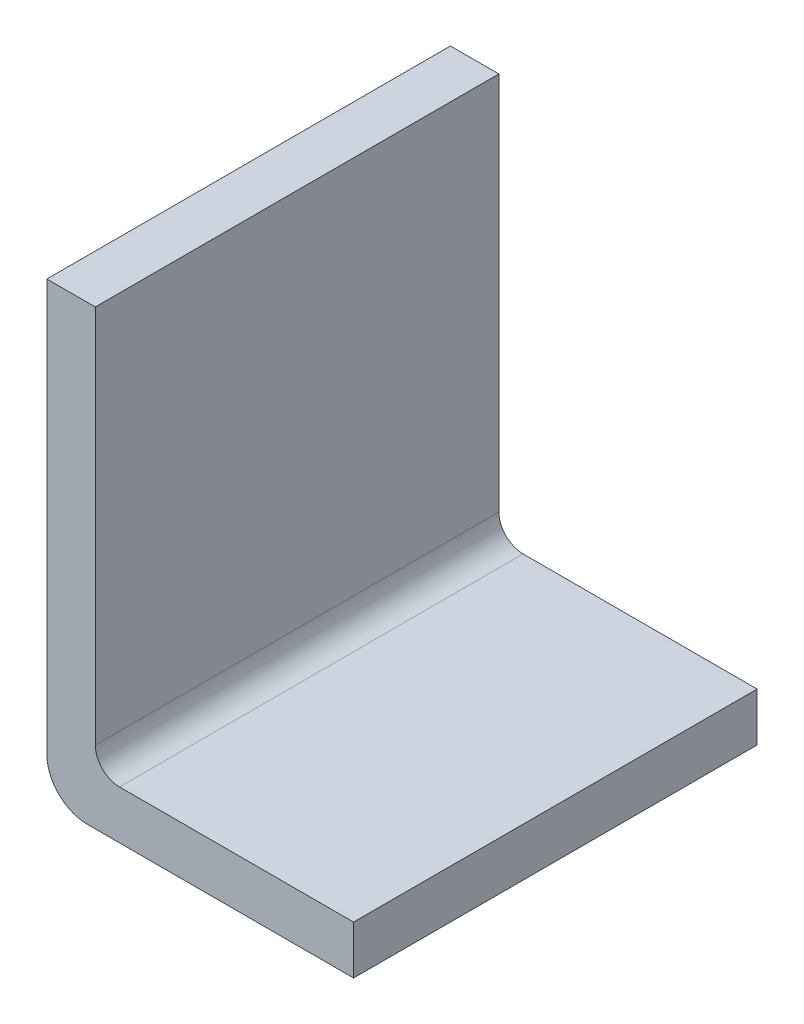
SolidWorks part; units mm, degrees
ref_plane "前视基准面" through (0, 0, 0) normal (0, 0, 1) x (1, 0, 0)
ref_plane "上视基准面" through (0, 0, 0) normal (0, 1, 0) x (1, 0, 0)
ref_plane "右视基准面" through (0, 0, 0) normal (1, 0, 0) x (0, 0, -1)
sketch "草图1" plane through (0, 0, 0) normal (0, 0, 1) x (1, 0, 0)
  line L0 (0, 56) -> (0, 5)
  line L1 (5, 0) -> (38, 0)
  line L2 (38, 0) -> (38, 6)
  line L3 (38, 6) -> (9, 6)
  line L4 (6, 9) -> (6, 56)
  line L5 (6, 56) -> (0, 56)
  arc A0 (0, 5) -> (5, 0) centre (5, 5) ccw
  arc A1 (9, 6) -> (6, 9) centre (9, 9) cw
  point P9 (0, 0)
  dimension "D5" = 5
  dimension "D6" = 3
  dimension "D1" = 56
  dimension "D2" = 6
  dimension "D3" = 6
  dimension "D4" = 32
extrude "拉伸1" add sketch "草图1" along normal blind 50
